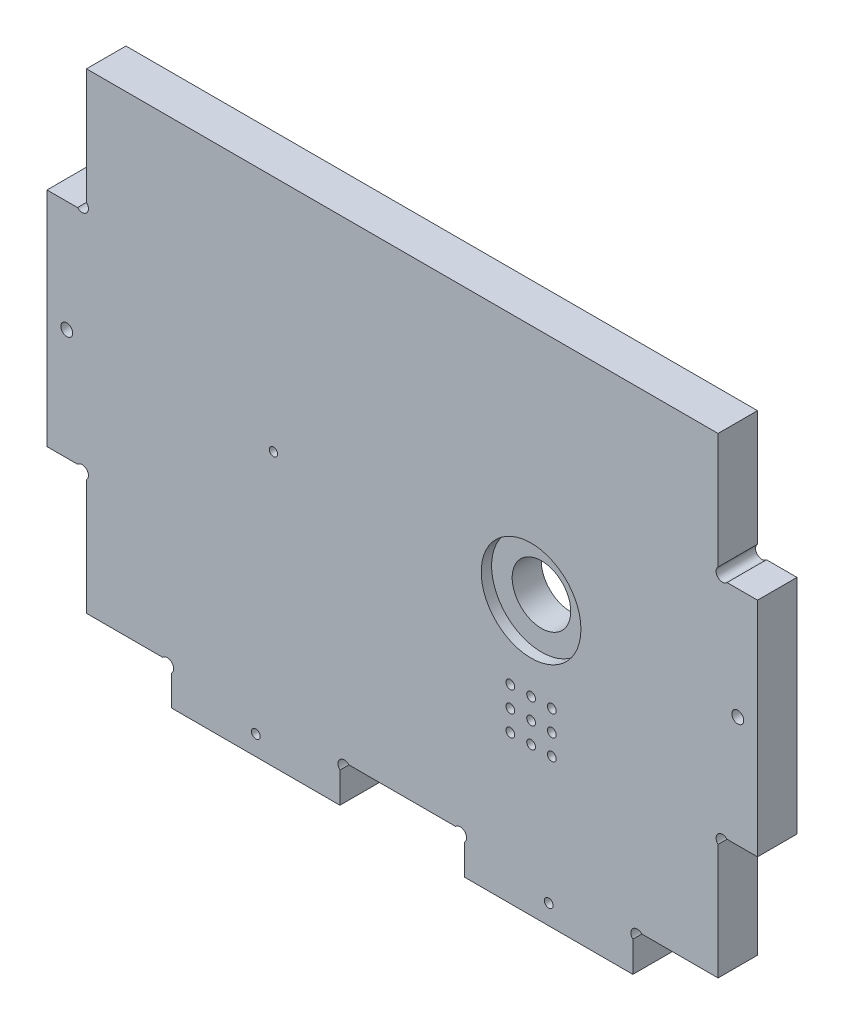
SolidWorks part; units mm, degrees
ref_plane "Plan de face" through (0, 0, 0) normal (0, 0, 1) x (1, 0, 0)
ref_plane "Plan de dessus" through (0, 0, 0) normal (0, 1, 0) x (1, 0, 0)
ref_plane "Plan de droite" through (0, 0, 0) normal (1, 0, 0) x (0, 0, -1)
sketch "Esquisse1" plane through (0, 0, 0) normal (0, 0, 1) x (1, 0, 0)
  line L0 (0, 265.9993) -> (0, -156.1765) construction
  line L1 (-171, 0) -> (0, 0) construction
  line L2 (-171, 186) -> (-171, 79)
  line L3 (-152, 246) -> (152, 246)
  line L4 (171, 79) -> (171, 186)
  line L5 (-202.3818, 19) -> (246.8932, 19) construction
  line L6 (152, 276.6963) -> (152, -75.5923) construction
  line L7 (111, 32.8042) -> (111, -22.1072) construction
  line L8 (30, 37.7961) -> (30, -22.1072) construction
  line L9 (111, 14.6881) -> (111, 0)
  line L10 (115.3119, 19) -> (152, 19)
  line L11 (30, 0) -> (30, 14.6881)
  line L12 (25.6881, 19) -> (-25.6881, 19)
  line L13 (111, 79) -> (211.2364, 79) construction
  line L14 (30, 0) -> (111, 0)
  line L15 (111, 186) -> (224.0729, 186) construction
  line L16 (152, 246) -> (152, 190.3119)
  line L17 (156.3119, 186) -> (171, 186)
  line L18 (171, 79) -> (156.3119, 79)
  line L19 (152, 74.6881) -> (152, 19)
  line L20 (-115.3119, 19) -> (-152, 19)
  line L21 (-111, 14.6881) -> (-111, 0)
  line L22 (-30, 0) -> (-111, 0)
  line L23 (-30, 0) -> (-30, 14.6881)
  line L24 (-171, 79) -> (-156.3119, 79)
  line L25 (-152, 74.6881) -> (-152, 19)
  line L26 (-152, 246) -> (-152, 190.3119)
  line L27 (-156.3119, 186) -> (-171, 186)
  arc A0 (152, 190.3119) -> (156.3119, 186) centre (154.1, 188.1) ccw
  arc A1 (156.3119, 79) -> (152, 74.6881) centre (154.1, 76.9) ccw
  arc A2 (115.3119, 19) -> (111, 14.6881) centre (113.1, 16.9) ccw
  arc A3 (30, 14.6881) -> (25.6881, 19) centre (27.9, 16.9) ccw
  arc A4 (-115.3119, 19) -> (-111, 14.6881) centre (-113.1, 16.9) cw
  arc A5 (-30, 14.6881) -> (-25.6881, 19) centre (-27.9, 16.9) cw
  arc A6 (-156.3119, 79) -> (-152, 74.6881) centre (-154.1, 76.9) cw
  arc A7 (-152, 190.3119) -> (-156.3119, 186) centre (-154.1, 188.1) cw
  circle A8 centre (161.5, 132.5) radius 2.8669
  circle A9 centre (-161.5, 132.5) radius 2.8669
  circle A10 centre (70.5, 9.5) radius 2.1
  circle A11 centre (-70.5, 9.5) radius 2.1
  point P47 (0, 19)
  dimension "D10" = 2.1
  dimension "D19" = 9.5
  dimension "D2" = 246
  dimension "D3" = 9.5
  dimension "D4" = 19
  dimension "D5" = 19
  dimension "D6" = 60
  dimension "D7" = 30
  dimension "D8" = 60
  dimension "D9" = 60
  dimension "D11" = 2.1
  dimension "D12" = 2.1
  dimension "D13" = 2.1
  dimension "D14" = 2.1
  dimension "D15" = 2.1
  dimension "D16" = 2.1
  dimension "D17" = 2.1
  dimension "D18" = 53.5
  dimension "D20" = 40.5
extrude "Boss.-Extru.1" add sketch "Esquisse1" along normal blind 19
sketch "Esquisse2" plane through (0, 0, 19) normal (0, 0, 1) x (1, 0, 0)
  line L0 (62, 255.5409) -> (62, 13.7058) construction
  line L1 (-122.6524, 131.3272) -> (121.9585, 131.3272) construction
  line L2 (152, 190.3119) -> (152, 246) construction
  line L3 (-62, 255.5409) -> (-62, 82.752) construction
  line L4 (-152, 246) -> (-152, 190.3119) construction
  line L5 (0, 81.3272) -> (121.9585, 81.3272) construction
  circle A0 centre (62, 131.3272) radius 14.1
  circle A1 centre (-62, 131.3272) radius 2
  circle A2 centre (62, 81.3272) radius 2.1
  circle A3 centre (72, 81.3272) radius 2.1
  circle A5 centre (62, 91.3272) radius 2.1
  circle A6 centre (72, 91.3272) radius 2.1
  circle A8 centre (52, 91.3272) radius 2.1
  circle A9 centre (52, 81.3272) radius 2.1
  circle A13 centre (72, 71.3272) radius 2.1
  circle A14 centre (52, 71.3272) radius 2.1
  circle A16 centre (62, 71.3272) radius 2.1
  circle A17 centre (82, 91.3272) radius 2.1
  circle A18 centre (82, 81.3272) radius 2.1
  dimension "D3" = 50
  dimension "D4" = 3
  dimension "D1" = 90
  dimension "D2" = 90
  dimension "D5" = 2
extrude "Enlèv. mat.-Extru.1" cut sketch "Esquisse2" against normal through all
sketch "Esquisse3" plane through (0, 0, 19) normal (0, 0, 1) x (1, 0, 0)
  circle A0 centre (62, 131.3272) radius 24
extrude "Enlèv. mat.-Extru.2" cut sketch "Esquisse3" against normal blind 5
